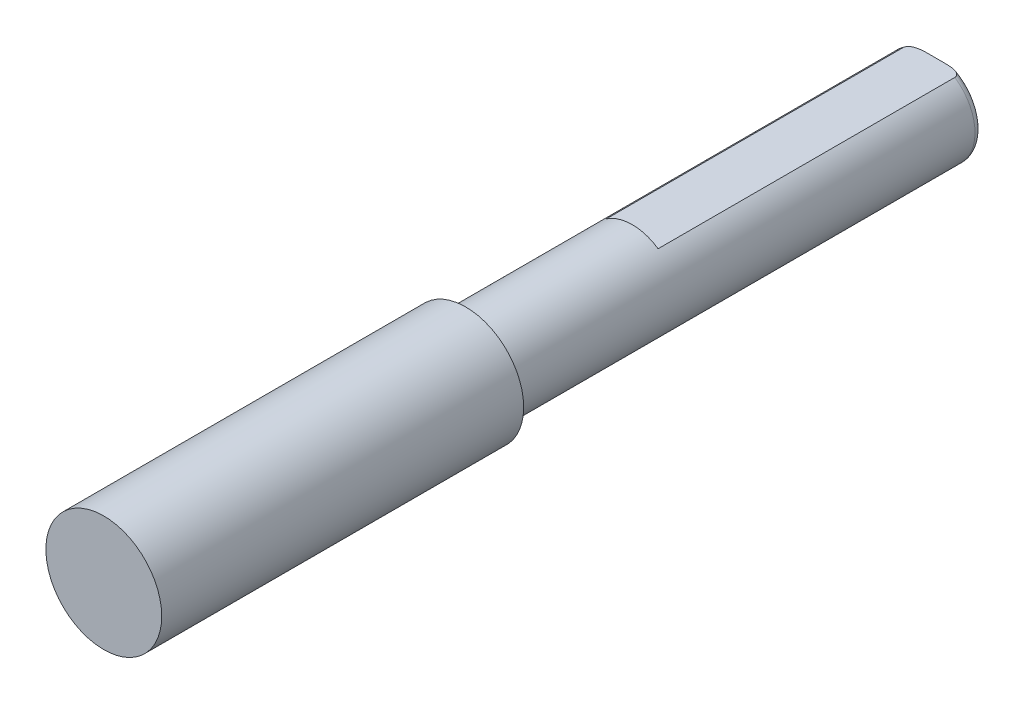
SolidWorks part; units mm, degrees
ref_plane "前视" through (0, 0, 0) normal (0, 0, 1) x (1, 0, 0)
ref_plane "上视" through (0, 0, 0) normal (0, 1, 0) x (1, 0, 0)
ref_plane "右视" through (0, 0, 0) normal (1, 0, 0) x (0, 0, -1)
sketch "草图2" plane through (0, 0, 0) normal (0, 0, 1) x (1, 0, 0)
  circle A0 centre (0, 0) radius 3.175
extrude "凸台-拉伸1" add sketch "草图2" along normal blind 32.5
sketch "草图3" plane through (0, 0, 32.5) normal (0, 0, 1) x (1, 0, 0)
  circle A0 centre (0, 0) radius 4
extrude "凸台-拉伸2" add sketch "草图3" along normal blind 25
sketch "草图4" plane through (0, 0, 0) normal (0, 0, -1) x (-1, 0, 0)
  line L0 (-1.7861, 2.625) -> (1.7861, 2.625)
  arc A0 (1.7861, 2.625) -> (-1.7861, 2.625) centre (0, 0) ccw
extrude "切除-拉伸1" cut sketch "草图4" against normal blind 21
fillet "圆角1" radius 0.5 1 edges at (0, -3.175, 0)
